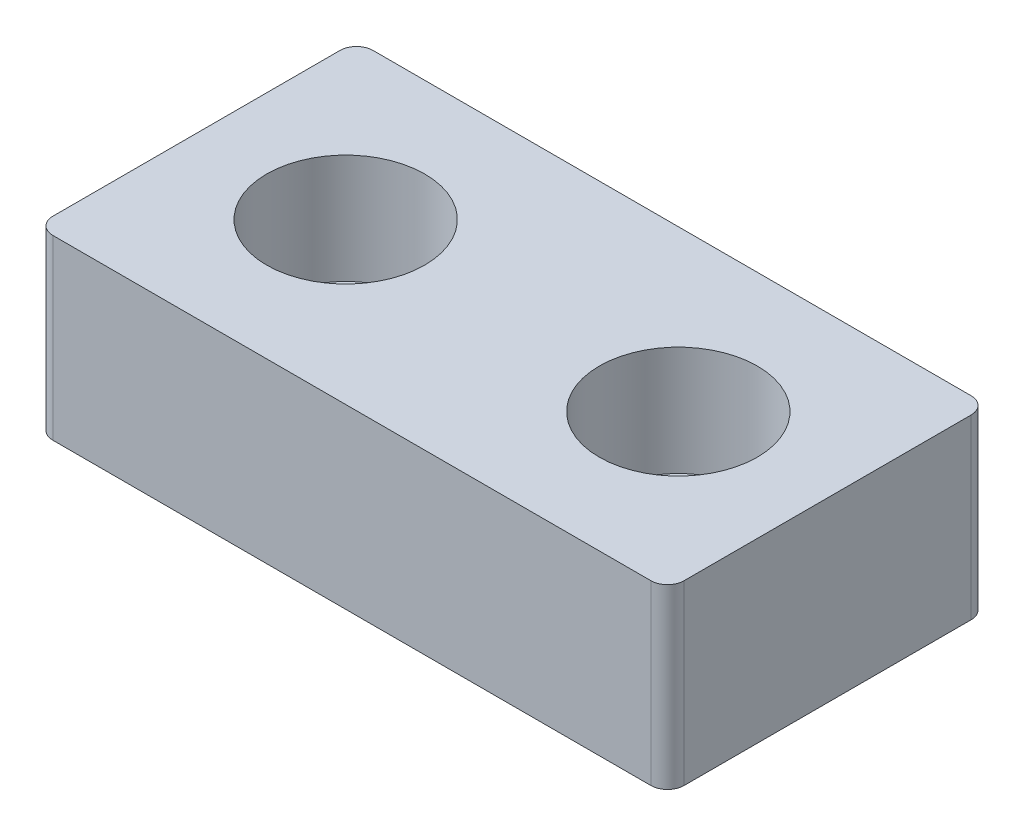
SolidWorks part; units mm, degrees
ref_plane "Front Plane" through (0, 0, 0) normal (0, 0, 1) x (1, 0, 0)
ref_plane "Top Plane" through (0, 0, 0) normal (0, 1, 0) x (1, 0, 0)
ref_plane "Right Plane" through (0, 0, 0) normal (1, 0, 0) x (0, 0, -1)
curve "ImportedCurve1"
curve "ImportedCurve2"
curve "ImportedCurve3"
curve "ImportedCurve4"
curve "ImportedCurve5"
curve "ImportedCurve6"
curve "ImportedCurve7"
curve "ImportedCurve8"
curve "ImportedCurve9"
curve "ImportedCurve10"
curve "ImportedCurve11"
curve "ImportedCurve12"
curve "ImportedCurve13"
curve "ImportedCurve14"
curve "ImportedCurve15"
curve "ImportedCurve16"
curve "ImportedCurve17"
curve "ImportedCurve18"
curve "ImportedCurve19"
curve "ImportedCurve20"
curve "ImportedCurve21"
curve "ImportedCurve22"
curve "ImportedCurve23"
curve "ImportedCurve24"
curve "ImportedCurve25"
curve "ImportedCurve26"
curve "ImportedCurve27"
curve "ImportedCurve28"
curve "ImportedCurve29"
curve "ImportedCurve30"
curve "ImportedCurve31"
curve "ImportedCurve32"
curve "ImportedCurve33"
curve "ImportedCurve34"
curve "ImportedCurve35"
curve "ImportedCurve36"
sketch "Sketch2" plane through (0, 0, 0) normal (0, 1, 0) x (1, 0, 0)
  line L0 (-57.805, 42.0432) -> (-42.565, 42.0432) construction
  line L1 (-64.6465, 35.4676) -> (-64.6465, 48.6188) construction
  line L2 (-35.7234, 34.7056) -> (-64.6465, 34.7056)
  line L3 (-35.7234, 34.7056) -> (-35.7234, 49.3808)
  line L4 (-35.7234, 49.3808) -> (-64.6465, 49.3808)
  line L5 (-64.6465, 34.7056) -> (-64.6465, 49.3808)
  line L6 (-50.185, 49.3808) -> (-50.185, 34.7056) construction
  line L7 (-35.7234, 42.0432) -> (-64.6465, 42.0432) construction
  line L8 (-36.4854, 34.7056) -> (-63.8845, 34.7056) construction
  arc A0 (-38.9455, 42.0432) -> (-46.1845, 42.0432) centre (-42.565, 42.0432) ccw construction
  arc A2 (-61.4245, 42.0432) -> (-54.1855, 42.0432) centre (-57.805, 42.0432) ccw construction
  point P5 (-50.185, 42.0432)
  point P6 (-50.185, 42.0432)
extrude "Boss-Extrude1" add sketch "Sketch2" along normal up to vertex (6.304 mm away) from vertex at -1.824
fillet "Fillet1" radius 0.762 4 edges at (-64.6465, 2.24, -49.3808) (-35.7234, 2.24, -49.3808) (-35.7234, 2.24, -34.7056) (-64.6465, 2.24, -34.7056)
hole_wizard "CBORE for M4 SHCS1" positions "Sketch4" profile "Sketch3" counterbore size "M4" standard "ANSI Metric"
sketch "Sketch4" plane through (0, 6.304, 0) normal (0, 1, 0) x (1, 0, 0)
  point P0 (-57.805, 42.0432)
  point P2 (-42.565, 42.0432)
sketch "Sketch3" plane through (-57.805, 6.304, -42.0432) normal (1, 0, 0) x (0, 0, 1)
  line L0 (0, 0) -> (0, 16.2779)
  line L1 (0, 16.2779) -> (2.15, 14.986)
  line L2 (2.15, 14.986) -> (2.15, 5.016)
  line L3 (2.15, 5.016) -> (3.6195, 5.016)
  line L4 (3.6195, 5.016) -> (3.6195, 0)
  line L5 (3.6195, 0) -> (0, 0)
  line L10 (0, 16.2779) -> (-2.15, 14.986) construction
  line L11 (0, -6.35) -> (0, 107.95) construction
  dimension "Hole Dia." = 4.3
  dimension "Hole Depth" = 14.986
  dimension "C'Bore Dia." = 7.239
  dimension "C'Bore Depth" = 5.016
  dimension "Drill Angle" = 118
